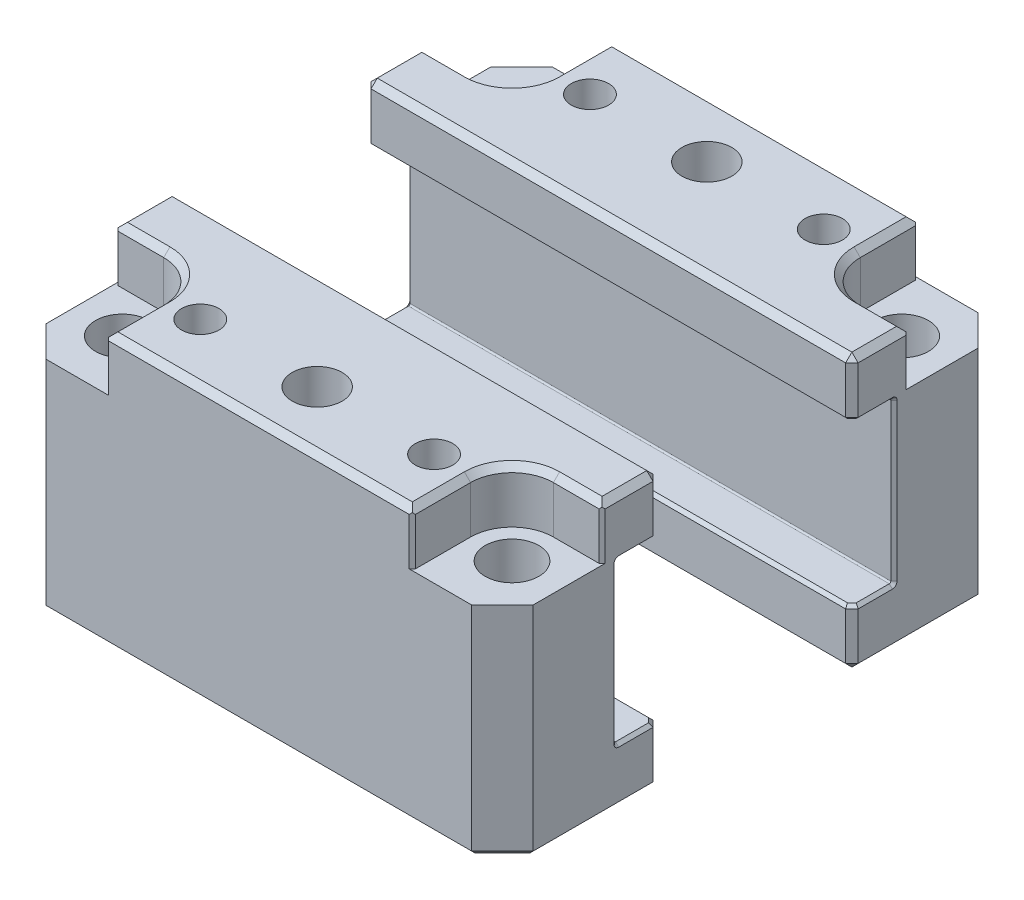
SolidWorks part; units mm, degrees
ref_plane "Front Plane" through (0, 0, 0) normal (0, 0, 1) x (1, 0, 0)
ref_plane "Top Plane" through (0, 0, 0) normal (0, 1, 0) x (1, 0, 0)
ref_plane "Right Plane" through (0, 0, 0) normal (1, 0, 0) x (0, 0, -1)
sketch "Sketch1" plane through (0, 0, 0) normal (1, 0, 0) x (0, 0, -1)
  line L0 (-15.6972, 0) -> (-15.6972, 44.45)
  line L1 (-15.6972, 44.45) -> (-41.2496, 44.45)
  line L2 (-41.2496, 44.45) -> (-41.2496, 0)
  line L3 (-41.2496, 0) -> (-15.6972, 0)
  line L4 (0, 48.255) -> (0, -16.2311) construction
  dimension "D1" = 31.3944
  dimension "D2" = 44.45
  dimension "D3" = 82.4992
  dimension "D4" = 25.5524
extrude "Boss-Extrude1" add sketch "Sketch1" along normal mid plane 79.375
hole_wizard "CBORE for 5/16 Socket Head Cap Screw1" positions "Sketch4" profile "Sketch3" counterbore size "5/16" standard "ANSI Inch"
sketch "Sketch4" plane through (0, 44.45, 0) normal (0, 1, 0) x (1, 0, 0)
  line L0 (0, 7.4267) -> (0, -36.2312) construction
  line L2 (-19.6518, 0) -> (14.0148, 0) construction
  point P0 (-31.75, -31.75)
  point P11 (31.75, -31.75)
  dimension "D1" = 63.5
  dimension "D2" = 63.5
sketch "Sketch3" plane through (-31.75, 44.45, 31.75) normal (1, 0, 0) x (0, 0, 1)
  line L0 (0, 0) -> (0, 44.45)
  line L1 (0, 44.45) -> (4.365, 44.45)
  line L3 (4.365, 44.45) -> (4.365, 8.6995)
  line L4 (4.365, 8.6995) -> (6.7475, 8.6995)
  line L5 (6.7475, 8.6995) -> (6.7475, 0)
  line L7 (6.7475, 0) -> (0, 0)
  line L11 (0, -6.35) -> (0, 107.95) construction
  dimension "Thru Hole Dia." = 8.73
  dimension "Thru Hole Depth" = 44.45
  dimension "C'Bore Dia." = 13.495
  dimension "C'Bore Depth" = 8.6995
hole_wizard "3/8-16 Tapped Hole5" positions "Sketch6" profile "Sketch5" tap size "3/8-16" standard "ANSI Inch"
sketch "Sketch6" plane through (0, 44.45, 0) normal (0, 1, 0) x (1, 0, 0)
  line L0 (0, 2.7703) -> (0, -32.9614) construction
  line L2 (-8.3627, 0) -> (4.6629, 0) construction
  line L4 (31.75, -31.75) -> (-31.75, -31.75) construction
  point P2 (0, -31.75)
sketch "Sketch5" plane through (0, 44.45, 31.75) normal (1, 0, 0) x (0, 0, 1)
  line L0 (0, 0) -> (0, 30.3819)
  line L1 (0, 30.3819) -> (4.064, 27.94)
  line L2 (4.064, 27.94) -> (4.064, 0)
  line L5 (4.064, 0) -> (0, 0)
  line L10 (0, 30.3819) -> (-4.064, 27.94) construction
  line L11 (0, -6.35) -> (0, 107.95) construction
  dimension "Tap Drill Dia." = 8.128
  dimension "Tap Drill Depth" = 27.94
  dimension "Drill Angle" = 118
chamfer "Chamfer1" distance 5 angle 45 2 edges at (39.6875, 22.225, 41.2496) (-39.6875, 22.225, 41.2496)
ref_plane "Plane2" through (0, 0, 31.75) normal (0, 0, 1) x (1, 0, 0)
sketch "Sketch19" plane through (0, 0, 31.75) normal (0, 0, 1) x (1, 0, 0)
  line L0 (-22.098, 44.45) -> (-22.098, 12.7763)
  line L1 (-22.098, 12.7763) -> (-22.225, 12.7)
  line L2 (-22.225, 12.7) -> (-22.225, 0)
  line L3 (-22.225, 0) -> (-19.05, 0)
  line L4 (-19.05, 0) -> (-19.05, 44.45)
  line L5 (-19.05, 44.45) -> (-22.098, 44.45)
  line L6 (-19.05, 51.2326) -> (-19.05, -4.206) construction
  line L7 (34.6875, 0) -> (-34.6875, 0) construction
  line L8 (34.6875, 44.45) -> (-34.6875, 44.45) construction
  line L9 (0, 0) -> (0, 49.0376) construction
  line L10 (0, 16.51) -> (0, 44.45) construction
  line L11 (0, 16.51) -> (0, 14.0681) construction
  dimension "D1" = 12.7
  dimension "D2" = 59
  dimension "D3" = 6.096
  dimension "D4" = 6.35
  dimension "D5" = 38.1
revolve "Cut-Revolve1" cut sketch "Sketch19" angle 360 about L6
mirror "Mirror1" about plane through (0, 0, 0) normal (1, 0, 0) of "Cut-Revolve1"
sketch "Sketch8" plane through (0, 44.45, 0) normal (0, 1, 0) x (1, 0, 0)
  line L0 (0, -10.3673) -> (0, -49.2) construction
  line L2 (-31.75, -25.0025) -> (-39.6875, -25.0025)
  line L3 (-39.6875, -15.6972) -> (-39.6875, -36.2496) construction
  line L4 (-39.6875, -25.0025) -> (-39.6875, -41.2496)
  line L5 (-39.6875, -41.2496) -> (-25.0025, -41.2496)
  line L6 (34.6875, -41.2496) -> (-34.6875, -41.2496) construction
  line L7 (-25.0025, -41.2496) -> (-25.0025, -31.75)
  line L8 (25.0025, -41.2496) -> (25.0025, -31.75)
  line L9 (39.6875, -41.2496) -> (25.0025, -41.2496)
  line L10 (39.6875, -25.0025) -> (39.6875, -41.2496)
  line L11 (31.75, -25.0025) -> (39.6875, -25.0025)
  circle A0 centre (-31.75, -31.75) radius 6.7475 construction
  circle A1 centre (-31.75, -31.75) radius 6.7475 construction
  arc A2 (-25.0025, -31.75) -> (-31.75, -25.0025) centre (-31.75, -31.75) ccw
  arc A3 (25.0025, -31.75) -> (31.75, -25.0025) centre (31.75, -31.75) cw
extrude "Cut-Extrude3" cut sketch "Sketch8" against normal up to surface (8.6995 mm away)
sketch "Sketch9" plane through (0, 0, 15.6972) normal (0, 0, -1) x (-1, 0, 0)
  line L0 (0, 44.45) -> (0, 0) construction
  line L1 (-39.6875, 44.45) -> (39.6875, 44.45) construction
  line L2 (39.6875, 0) -> (39.6875, 44.45) construction
  line L3 (-39.6875, 35.2298) -> (39.6875, 35.2298)
  line L4 (-39.6875, 35.2298) -> (-39.6875, 9.2202)
  line L5 (-39.6875, 9.2202) -> (39.6875, 9.2202)
  line L6 (39.6875, 35.2298) -> (39.6875, 9.2202)
  line L7 (-39.6875, 35.2298) -> (39.6875, 9.2202) construction
  line L8 (-39.6875, 9.2202) -> (39.6875, 35.2298) construction
  line L9 (-39.6875, 0) -> (-39.6875, 44.45) construction
  line L10 (0, 22.225) -> (42.9303, 22.225) construction
  point P5 (0, 22.225)
  dimension "D1" = 26.0096
  dimension "D2" = 0
extrude "Cut-Extrude4" cut sketch "Sketch9" against normal offset from surface (6.858 mm away) 22.5552
hole_wizard "3/8-16 Tapped Hole4" positions "Sketch17" profile "Sketch16" tap size "3/8-16" standard "ANSI Inch"
sketch "Sketch17" plane through (0, 0, 0) normal (0, -1, 0) x (-1, 0, 0)
  point P0 (31.75, -31.75)
  point P3 (-31.75, -31.75)
sketch "Sketch16" plane through (-31.75, 0, 31.75) normal (1, 0, 0) x (0, 0, -1)
  line L0 (0, 0) -> (0, 44.45)
  line L1 (0, 44.45) -> (4.3688, 44.45)
  line L2 (4.3688, 44.45) -> (4.3688, 0)
  line L5 (4.3688, 0) -> (0, 0)
  line L11 (0, -6.35) -> (0, 107.95) construction
  dimension "Thru Tap Drill Dia." = 8.7376
  dimension "Thru Tap Drill Depth" = 44.45
ref_plane "Plane1" through (0, 22.225, 0) normal (0, 1, 0) x (1, 0, 0)
fillet "Fillet1" radius 0.254 2 edges at (0, 9.2202, 22.5552) (0, 35.2298, 22.5552)
chamfer "Chamfer2" distance 1.016 angle 45 20 edges at (-26.9788, 44.45, 26.9788) (0, 44.45, 41.2496) (-39.6875, 44.45, 20.3498) (-39.6875, 39.8399, 15.6972) (0, 44.45, 15.6972) (26.9788, 44.45, 26.9788) (39.6875, 44.45, 20.3498) (39.6875, 39.8399, 15.6972) (0, 0, 15.6972) (-39.6875, 4.6101, 15.6972) (-39.6875, 0, 25.9734) (-37.1875, 0, 38.7496) (0, 0, 41.2496) (37.1875, 0, 38.7496) (39.6875, 0, 25.9734) (39.6875, 4.6101, 15.6972) (-25.0025, 44.45, 36.4998) (-35.7187, 44.45, 25.0025) (25.0025, 44.45, 36.4998) (35.7187, 44.45, 25.0025)
chamfer "Chamfer3" distance 0.508 angle 45 4 edges at (39.6875, 39.5923, 25.0025) (25.0025, 39.5923, 41.2496) (-25.0025, 39.5923, 41.2496) (-39.6875, 39.5922, 25.0025)
chamfer "Chamfer4" distance 0.508 angle 45 16 edges at (39.1795, 9.2202, 16.2052) (0, 9.2202, 15.6972) (-39.1795, 9.2202, 16.2052) (-39.6875, 9.2202, 19.5072) (39.6875, 9.2202, 19.5072) (-39.6875, 9.2946, 22.4808) (39.6875, 9.2946, 22.4808) (-39.6875, 22.225, 22.5552) (39.6875, 22.225, 22.5552) (-39.6875, 35.1554, 22.4808) (39.6875, 35.1554, 22.4808) (-39.6875, 35.2298, 19.5072) (-39.1795, 35.2298, 16.2052) (0, 35.2298, 15.6972) (39.1795, 35.2298, 16.2052) (39.6875, 35.2298, 19.5072)
chamfer "Chamfer5" distance 0.508 angle 45 2 edges at (22.225, 0, 31.75) (-22.225, 0, 31.75)
mirror "Mirror2" about plane through (0, 0, 0) normal (0, 0, 1)
